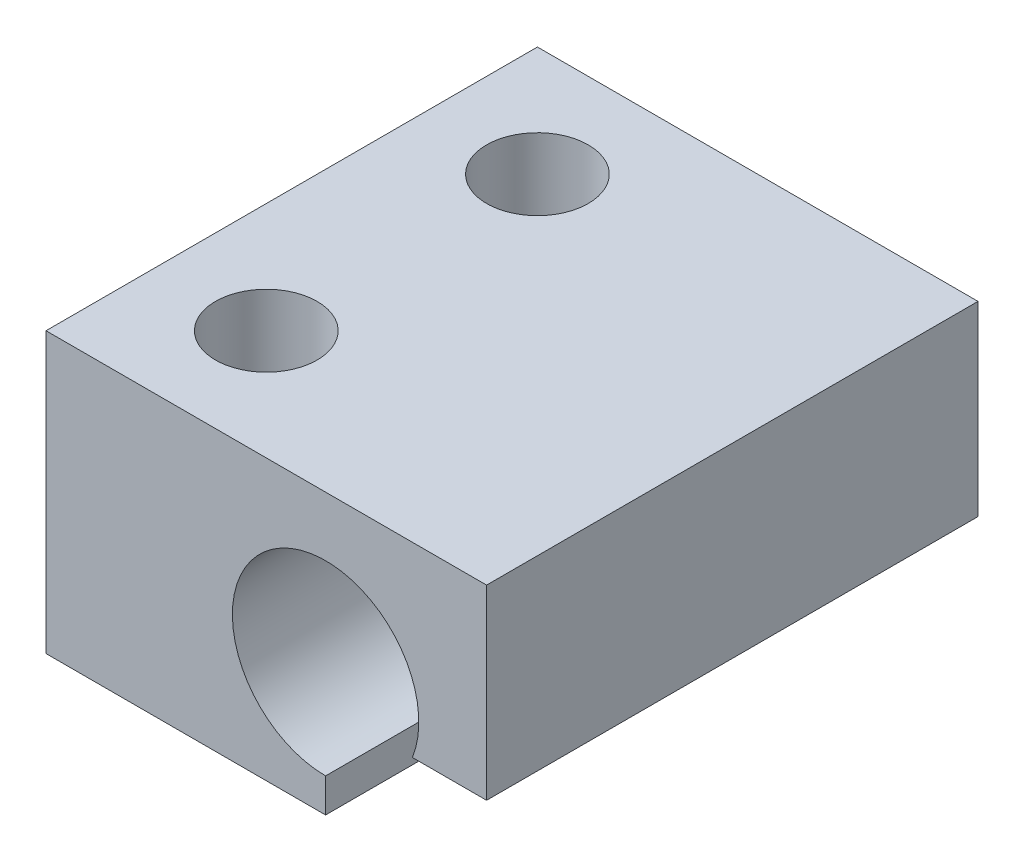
SolidWorks part; units mm, degrees
ref_plane "Alzado" through (0, 0, 0) normal (0, 0, 1) x (1, 0, 0)
ref_plane "Planta" through (0, 0, 0) normal (0, 1, 0) x (1, 0, 0)
ref_plane "Vista lateral" through (0, 0, 0) normal (1, 0, 0) x (0, 0, -1)
sketch "Croquis1" plane through (0, 0, 0) normal (0, 0, 1) x (1, 0, 0)
  line L0 (3.5, -6.25) -> (3.5, -8.25)
  line L1 (-13, 8.25) -> (13, 8.25)
  line L2 (-13, 8.25) -> (-13, -8.25)
  line L3 (-13, -8.25) -> (3.5, -8.25)
  line L4 (13, 8.25) -> (13, -2.75)
  line L6 (13, -2.75) -> (8.6235, -2.75)
  arc A1 (3.5, -6.25) -> (8.6235, -2.75) centre (3.5, -0.75) cw
extrude "Extruir1" add sketch "Croquis1" along normal blind 29
sketch "Croquis4" plane through (0, -8.25, 0) normal (0, -1, 0) x (1, 0, 0)
  point P0 (-6.5, 6.5)
  point P1 (-6.5, 22.5)
hole_wizard "Taladro1" positions "Croquis3D1" profile "Croquis6" legacy
sketch3d "Croquis3D1"
  point P1 (-6.5, -8.25, 22.5)
  point P4 (-6.5, -8.25, 6.5)
sketch "Croquis6" plane through (-6.5, -8.25, 22.5) normal (1, 0, 0) x (0, 0, -1)
  line L0 (0, 0) -> (0, 23.7426)
  line L1 (0, 23.7426) -> (3, 16.5)
  line L2 (3, 16.5) -> (3, 3.5)
  line L3 (3, 3.5) -> (4.75, 3.5)
  line L4 (4.75, 3.5) -> (4.75, 0)
  line L5 (4.75, 0) -> (0, 0)
  line L6 (0, -6.13) -> (0, 109.2824) construction
  line L7 (-3, 3.5) -> (-4.75, 3.5) construction
  line L8 (0, 23.7426) -> (-3, 16.5) construction
  dimension "Diámetro" = 6
  dimension "Profundidad" = 16.5
  dimension "Diámetro de perforado hasta intermedio" = 9.5
  dimension "Profundidad de perforado hasta intermedio" = 3.5
  dimension "Ángulo de perforado" = 45
  dimension "Ángulo de perforado hasta intermedio" = 180
